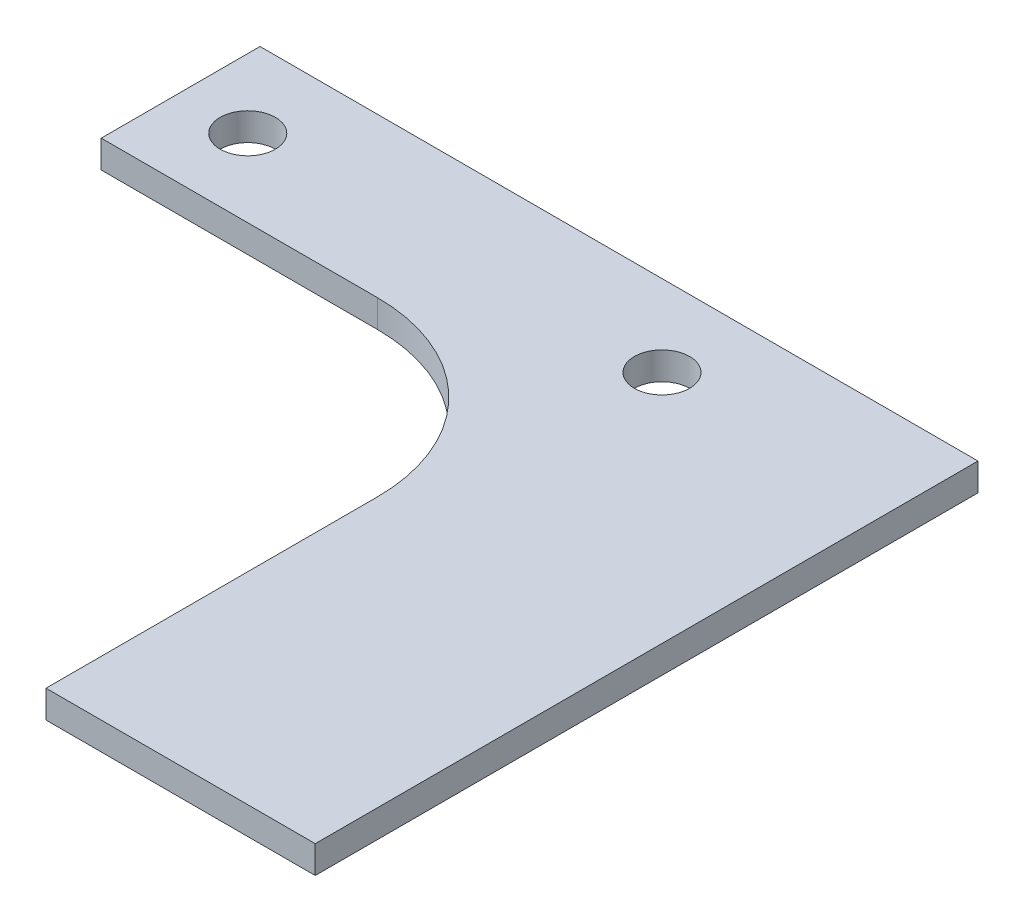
SolidWorks part; units mm, degrees
ref_plane "Front" through (0, 0, 0) normal (0, 0, 1) x (1, 0, 0)
ref_plane "Top" through (0, 0, 0) normal (0, 1, 0) x (1, 0, 0)
ref_plane "Right" through (0, 0, 0) normal (1, 0, 0) x (0, 0, -1)
sketch "Sketch1" plane through (0, 0, 0) normal (0, 1, 0) x (1, 0, 0)
  line L0 (25.4, 19.05) -> (-15.875, 19.05)
  line L2 (-25.4, -9.9219) -> (-25.4, -50.8)
  line L3 (-25.4, -50.8) -> (25.4, -50.8)
  line L4 (25.4, 19.05) -> (25.4, -50.8)
  line L5 (0, 0) -> (0, -50.8) construction
  line L6 (9.9219, 0) -> (15.875, 0) construction
  line L7 (0, -9.9219) -> (-25.4, -9.9219)
  line L10 (0, 9.9219) -> (-15.875, 9.9219)
  line L11 (-15.875, 9.9219) -> (-15.875, 19.05)
  line L12 (0, 15.875) -> (0, 9.9219) construction
  circle A0 centre (0, 0) radius 7.3025 construction
  arc A1 (0, -9.9219) -> (9.9219, 0) centre (0, 0) ccw
  arc A2 (15.875, 0) -> (-12.3924, 9.9219) centre (0, 0) ccw construction
  arc A3 (9.9219, 0) -> (0, 9.9219) centre (0, 0) ccw
  dimension "D4" = 14.605
  dimension "D5" = 19.8438
  dimension "D6" = 19.05
  dimension "D1" = 15.875
  dimension "D2" = 50.8
  dimension "D3" = 50.8
  dimension "D7" = 40.8781
extrude "Boss-Extrude1" add sketch "Sketch1" along normal blind 1.5875
sketch "Sketch2" plane through (0, 1.5875, 0) normal (0, 1, 0) x (1, 0, 0)
  circle A0 centre (0, 12.7) radius 0.127
  circle A1 centre (12.7, 0) radius 0.127
  circle A2 centre (0, 0) radius 12.7 construction
  dimension "D1" = 0.254
  dimension "D2" = 25.4
sketch "Sketch5" plane through (0, 1.5875, 0) normal (0, 1, 0) x (1, 0, 0)
  line L0 (25.4, 19.05) -> (-15.875, 19.05) construction
  circle A0 centre (11.9062, 14.3764) radius 1.5875
  circle A1 centre (-11.9063, 14.3764) radius 1.5875
  circle A4 centre (0, 0) radius 14.4217 construction
  circle A6 centre (-11.1125, -15.875) radius 1.5875
  dimension "D1" = 3.175
  dimension "D5" = 15.875
  dimension "D6" = 11.1125
  dimension "D2" = 4.6736
  dimension "D3" = 11.9062
  dimension "D4" = 11.9062
  dimension "D8" = 11.1125
extrude "Cut-Extrude2" cut sketch "Sketch5" against normal through all
sketch "Sketch6" plane through (0, 1.5875, 0) normal (0, 1, 0) x (1, 0, 0)
  line L0 (15.0813, -19.05) -> (-15.0812, -19.05) construction
  line L1 (31.7054, -55.1958) -> (-44.1091, -55.1958)
  line L2 (31.7054, -55.1958) -> (31.7054, -19.05)
  line L3 (31.7054, -19.05) -> (9.9219, -19.05)
  line L4 (-44.1091, -55.1958) -> (-44.1091, 0)
  line L5 (9.9219, 0) -> (9.9219, -19.05)
  line L6 (9.9219, 0) -> (-44.1091, 0)
  arc A1 (0, -9.9219) -> (0, 9.9219) centre (0, 0) ccw construction
extrude "Cut-Extrude3" cut sketch "Sketch6" against normal through all
equation "\"Buoyancy\"=\"SW-Volume\"*(\"SW-Density\"-.037062)"
